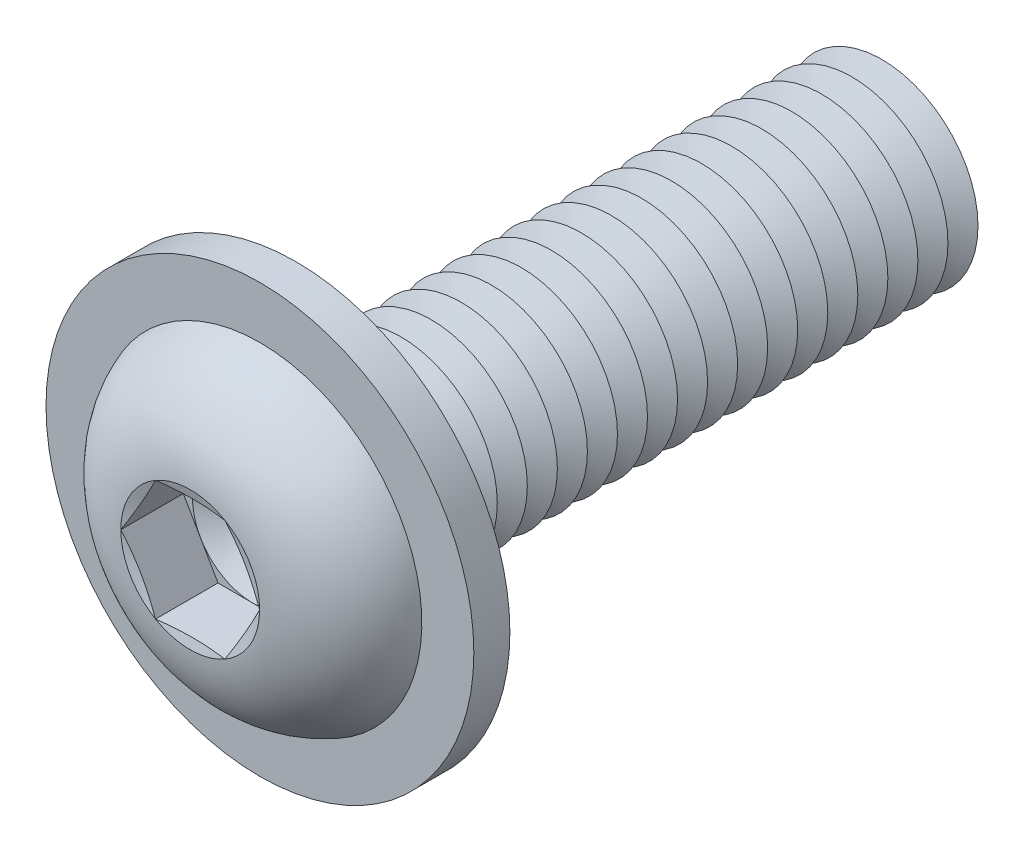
SolidWorks part; units mm, degrees
ref_plane "Front Plane" through (0, 0, 0) normal (0, 0, 1) x (1, 0, 0)
ref_plane "Top Plane" through (0, 0, 0) normal (0, 1, 0) x (1, 0, 0)
ref_plane "Right Plane" through (0, 0, 0) normal (1, 0, 0) x (0, 0, -1)
sketch "Sketch1" plane through (0, 0, 0) normal (1, 0, 0) x (0, 0, -1)
  line L0 (0, 4) -> (0, 7)
  line L3 (0, 4) -> (25, 4)
  line L4 (25, 4) -> (25, 0)
  line L5 (25, 0) -> (-4.4, 0) construction
  line L6 (-4.4, 0) -> (25, 0)
  line L7 (-4.4, 2.8867) -> (-4.4, 1.4434) construction
  line L8 (-4.4, 1.4434) -> (-4.4, 0)
  line L9 (-4.4, 2.8867) -> (-4.0132, 1.4434)
  line L10 (-4.0132, 1.4434) -> (-4.4, 1.4434)
  line L11 (25, 0) -> (22.7481, 0) construction
  line L12 (0, 7) -> (-4.4, 7) construction
  arc A1 (0, 7) -> (-4.4, 2.8867) centre (0, 2.59) ccw
  point P8 (25, 2)
  dimension "D1" = 14
  dimension "D2" = 8
  dimension "D3" = 4.4
  dimension "D4" = 5.7735
  dimension "D5" = 25
  dimension "D6" = 15
revolve "Revolve1" add sketch "Sketch1" angle 360 about L5
fillet "Fillet1" radius 0.625 1 edges at (-4, 0, 0)
sketch "Sketch2" plane through (0, 0, 0) normal (1, 0, 0) x (0, 0, -1)
  line L0 (24.375, 4) -> (25.625, 4)
  line L1 (25, 4) -> (0.625, 4) construction
  line L2 (25.625, 4) -> (25, 2.9175)
  line L3 (25, -4) -> (25, 4) construction
  line L4 (25, 2.9175) -> (24.375, 4)
  dimension "D1" = 1.25
revolve "Cut-Revolve1" cut sketch "Sketch2" angle 360 about axis through (0, 0, -25) along (0, 0, -1)
pattern_linear "LPattern1" count 20 spacing 1.25 along (0, 0, 1) of "Cut-Revolve1"
sketch "Sketch3" plane through (0, 0, 4.4) normal (0, 0, 1) x (1, 0, 0)
  line L7 (1.4434, 2.5) -> (-1.4434, 2.5)
  line L8 (-1.4434, 2.5) -> (-2.8867, 0)
  line L9 (-2.8867, 0) -> (-1.4434, -2.5)
  line L10 (-1.4434, -2.5) -> (1.4434, -2.5)
  line L11 (1.4434, -2.5) -> (2.8867, 0)
  line L12 (2.8867, 0) -> (1.4434, 2.5)
  circle A0 centre (0, 0) radius 2.5 construction
  circle A3 centre (0, 0) radius 2.8867 construction
extrude "Cut-Extrude1" cut sketch "Sketch3" against normal blind 2.6
sketch "Sketch4" plane through (0, 0, 1.8) normal (0, 0, 1) x (1, 0, 0)
  line L1 (1.4434, 2.5) -> (-1.4434, 2.5) construction
  circle A0 centre (0, 0) radius 2.5
extrude "Cut-Extrude2" cut sketch "Sketch4" against normal through all draft 60
sketch "Sketch5" plane through (0, 0, 0) normal (0, 0, -1) x (-1, 0, 0)
  circle A0 centre (0, 0) radius 8.9
  circle A1 centre (0, 0) radius 4.625
  circle A2 centre (0, 0) radius 4.625 construction
  dimension "D1" = 17.8
extrude "Boss-Extrude1" add sketch "Sketch5" against normal blind 1.5
